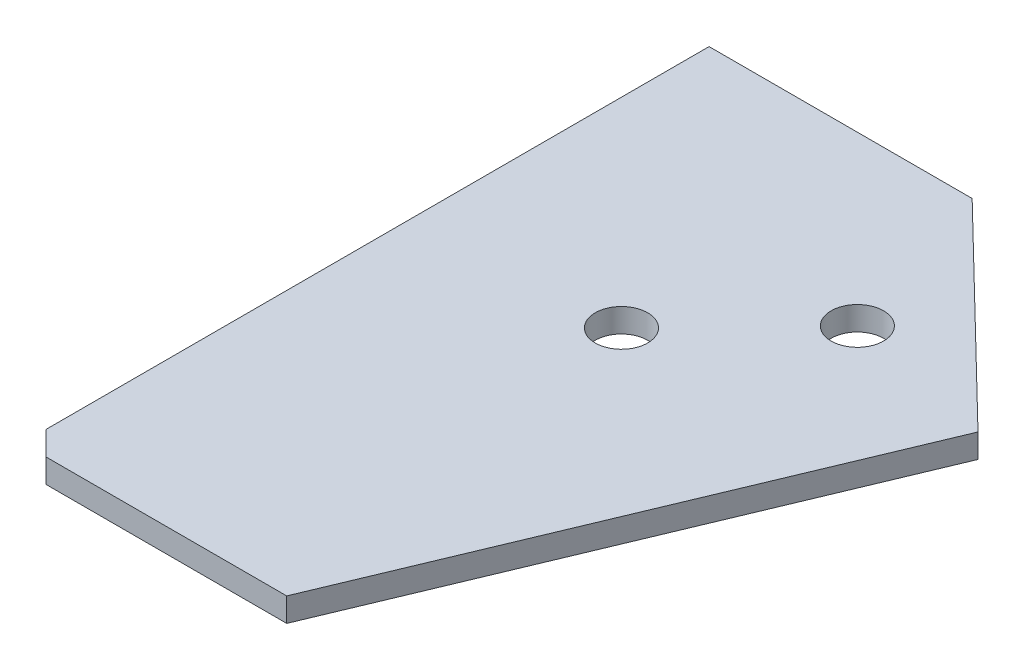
SolidWorks part; units mm, degrees
ref_plane "Front Plane" through (0, 0, 0) normal (0, 0, 1) x (1, 0, 0)
ref_plane "Top Plane" through (0, 0, 0) normal (0, 1, 0) x (1, 0, 0)
ref_plane "Right Plane" through (0, 0, 0) normal (1, 0, 0) x (0, 0, -1)
sketch "Sketch1" plane through (0, 0, 0) normal (0, 1, 0) x (1, 0, 0)
  line L0 (111, 0) -> (196.4513, 204.6075)
  line L1 (0, 0) -> (111, 0)
  line L2 (0, 0) -> (0, 288.2238)
  line L3 (110.3797, 288.2238) -> (0, 288.2238)
  line L4 (110.3797, 288.2238) -> (196.4513, 204.6075)
  dimension "D1" = 111
  dimension "D2" = 288.2238
  dimension "D3" = 110.3797
  dimension "D4" = 221.7345
extrude "Boss-Extrude1" add sketch "Sketch1" along normal mid plane 10
sketch "Brace Centre Line Sketch" plane through (0, 0, 0) normal (0, 1, 0) x (1, 0, 0)
  line L0 (-79, 0) -> (269.4012, 358.6315)
  line L1 (196.4513, 204.6075) -> (110.3797, 288.2238) construction
  dimension "D1" = 500
sketch "Hole Centres Sketch" plane through (0, 5, 0) normal (0, 1, 0) x (1, 0, 0)
  line L0 (83.8376, 167.6191) -> (132.6137, 217.8275) construction
  line L1 (83.8376, 167.6191) -> (59.4495, 142.5148) construction
  line L2 (132.6137, 217.8275) -> (157.0018, 242.9317) construction
  line L5 (-79, 0) -> (269.4012, 358.6315) construction
  line L7 (196.4513, 204.6075) -> (110.3797, 288.2238) construction
  dimension "D1" = 35
  dimension "D2" = 70
  dimension "D3" = 35
hole_wizard "Ø22.0 (22) Diameter Hole1" positions "Sketch4" profile "Sketch3" hole size "Ø22.0" standard "AS"
sketch "Sketch4" plane through (0, 5, 0) normal (0, 1, 0) x (-1, 0, 0)
  point P0 (-132.6137, -217.8275)
  point P4 (-83.8376, -167.6191)
sketch "Sketch3" plane through (132.6137, 5, -217.8275) normal (1, 0, 0) x (0, 0, 1)
  line L0 (0, 0) -> (0, 10)
  line L1 (0, 10) -> (11, 10)
  line L2 (11, 10) -> (11, 0)
  line L5 (11, 0) -> (0, 0)
  line L11 (0, -6.35) -> (0, 107.95) construction
  dimension "Thru Hole Dia." = 22
  dimension "Thru Hole Depth" = 10
chamfer "Chamfer2" distance 10 angle 45 1 edges at (0, 0, 0)
